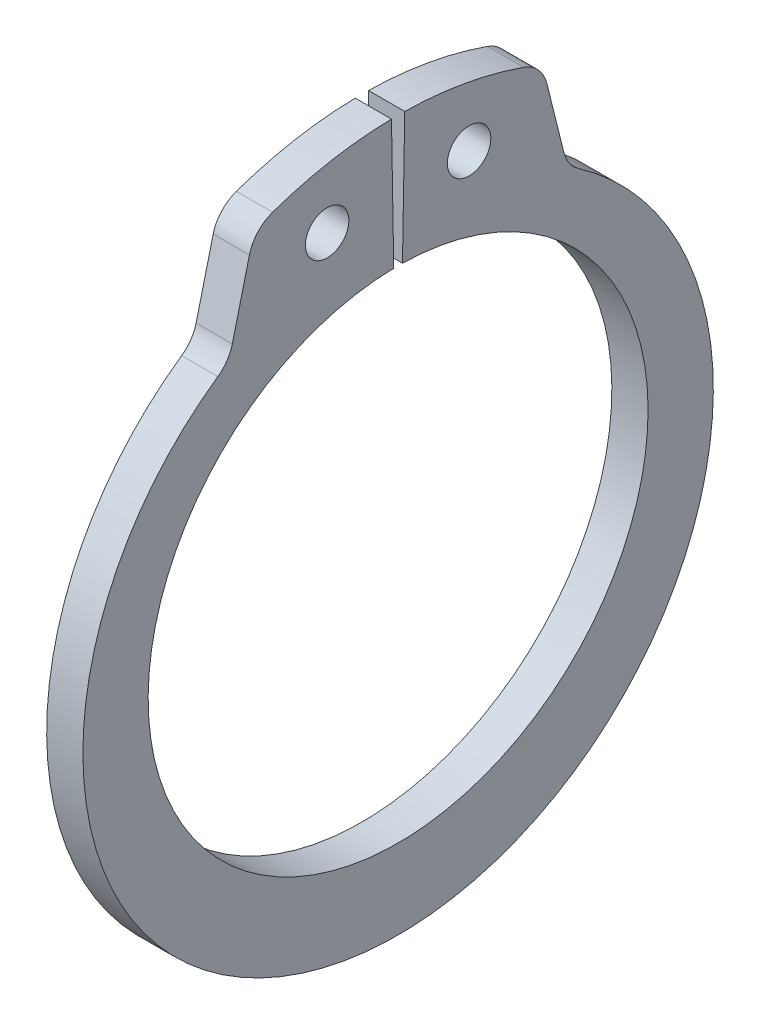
SolidWorks part; units mm, degrees
other "<217-2625-018 Rev1_98541A410>-<Imported1>"
ref_plane "Front Plane" through (0, 0, 0) normal (0, 0, 1) x (1, 0, 0)
ref_plane "Top Plane" through (0, 0, 0) normal (0, 1, 0) x (1, 0, 0)
ref_plane "Right Plane" through (0, 0, 0) normal (1, 0, 0) x (0, 0, -1)
mirrored part "217-2625-018 Rev1_98541A410_Mirrored"
